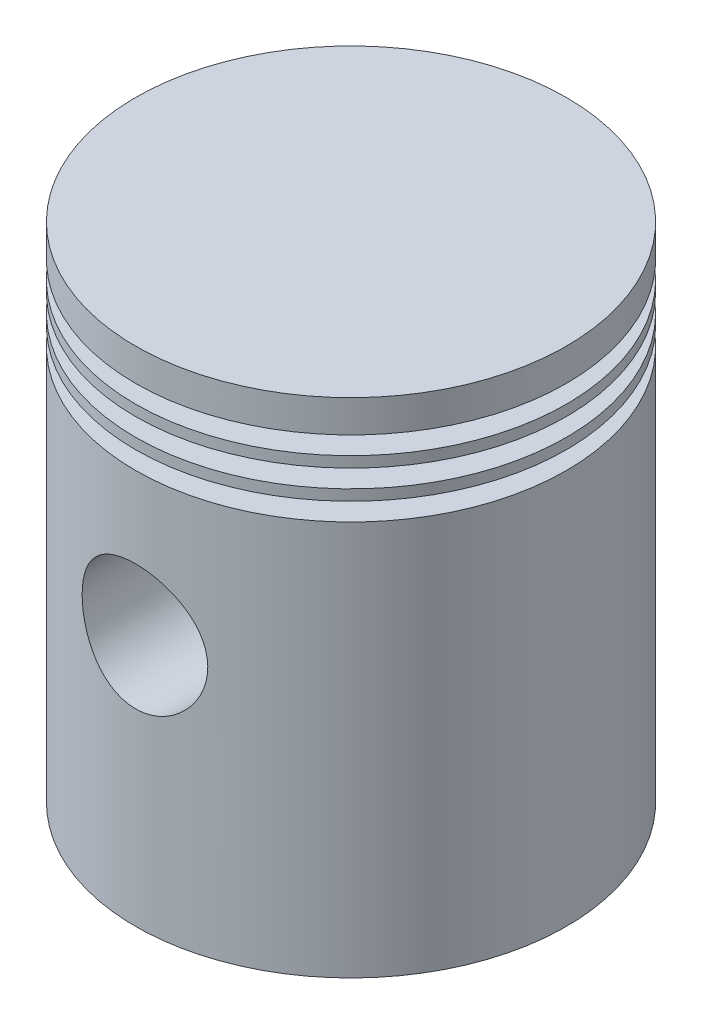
SolidWorks part; units mm, degrees
ref_plane "Front" through (0, 0, 0) normal (0, 0, 1) x (1, 0, 0)
ref_plane "Top" through (0, 0, 0) normal (0, 1, 0) x (1, 0, 0)
ref_plane "Right" through (0, 0, 0) normal (1, 0, 0) x (0, 0, -1)
sketch "Sketch1" plane through (0, 0, 0) normal (1, 0, 0) x (0, 0, -1)
  line L0 (38.1, 88.9) -> (0, 88.9)
  line L1 (0, 88.9) -> (0, 84.1375)
  line L2 (0, 84.1375) -> (28.575, 84.1375)
  line L3 (28.575, 84.1375) -> (28.575, 44.45)
  line L4 (28.575, 44.45) -> (34.925, 44.45)
  line L5 (34.925, 44.45) -> (34.925, 4.7625)
  line L6 (34.925, 4.7625) -> (33.3375, 4.7625)
  line L7 (33.3375, 4.7625) -> (33.3375, 0)
  line L8 (33.3375, 0) -> (38.1, 0)
  line L9 (38.1, 0) -> (38.1, 88.9)
  line L10 (0, 88.9) -> (0, 0) construction
  dimension "D1" = 28.575
  dimension "D2" = 33.3375
  dimension "D3" = 34.925
  dimension "D4" = 38.1
  dimension "D5" = 4.7625
  dimension "D6" = 44.45
  dimension "D7" = 84.1375
  dimension "D8" = 88.9
revolve "Main" add sketch "Sketch1" angle 180 about L10
ref_plane "CB Plane" through (0, 0, 13.208) normal (0, 0, 1) x (1, 0, 0)
sketch "Sketch5" plane through (0, 0, 13.208) normal (0, 0, 1) x (1, 0, 0)
  line L0 (0, -55.9859) -> (0, 55.9859) construction
  line L1 (-38.1, 0) -> (0, 0) construction
  line L2 (0, 0) -> (0, 88.9) construction
  line L3 (0, 30.1625) -> (0, 58.7375)
  arc A0 (0, 58.7375) -> (0, 30.1625) centre (0, 44.45) ccw
  dimension "D2" = 28.575
  dimension "D1" = 44.45
extrude "Circular Boss" add sketch "Sketch5" along normal up to next
sketch "Sketch6" plane through (0, 0, 13.208) normal (0, 0, 1) x (1, 0, 0)
  circle A0 centre (0, 44.45) radius 11.1125
  dimension "D1" = 22.225
extrude "Circular Cut" cut sketch "Sketch6" along normal through all
sketch "Sketch7" plane through (0, 7.4473, 55.2427) normal (1, 0, 0) x (0, 0, -1)
  line L0 (93.3427, 62.4027) -> (93.3427, 65.5777)
  line L1 (93.3427, 65.5777) -> (88.5802, 65.5777)
  line L2 (88.5802, 65.5777) -> (88.5802, 62.4027)
  line L3 (88.5802, 62.4027) -> (93.3427, 62.4027)
  line L4 (55.2427, 65.5777) -> (55.2427, 62.4027) construction
  line L7 (93.3427, -7.4473) -> (93.3427, 81.4527) construction
  dimension "D1" = 33.3375
  dimension "D2" = 38.1
  dimension "D3" = 3.175
  dimension "D4" = 69.85
revolve "Cut-Revolve1" cut sketch "Sketch7" angle 360 about L4
pattern_linear "LPattern1" count 3 spacing 5.08 along (0, 1, 0) of "Cut-Revolve1"
mirror "Mirror1" about plane through (0, 0, 0) normal (0, 0, 1) of "Circular Cut", "Circular Boss"
mirror "Mirror2"
